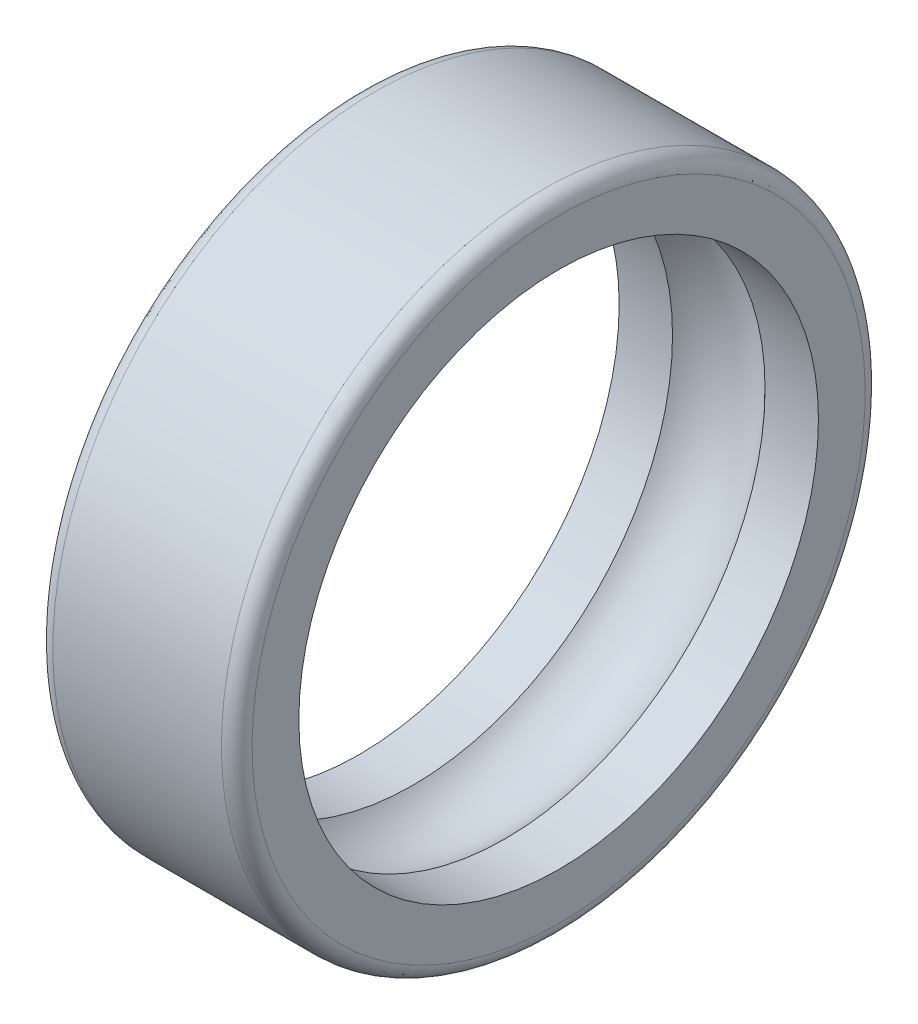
SolidWorks part; units mm, degrees
ref_plane "Plan de face" through (0, 0, 0) normal (0, 0, 1) x (1, 0, 0)
ref_plane "Plan de dessus" through (0, 0, 0) normal (0, 1, 0) x (1, 0, 0)
ref_plane "Plan de droite" through (0, 0, 0) normal (1, 0, 0) x (0, 0, -1)
sketch "Esquisse1" plane through (0, 0, 0) normal (0, 0, 1) x (1, 0, 0)
  line L0 (6.5, 21) -> (6.5, 7.5) construction
  line L1 (1, 21) -> (12, 21)
  line L2 (0, 20) -> (0, 8.5) construction
  line L3 (1, 7.5) -> (12, 7.5) construction
  line L4 (13, 20) -> (13, 8.5) construction
  line L5 (13, 16.95) -> (9.5187, 16.95)
  line L6 (13, 11.55) -> (0, 11.55) construction
  line L7 (0, 0) -> (13, 0) construction
  line L8 (13, 20) -> (13, 16.95)
  line L9 (0, 16.95) -> (0, 20)
  line L10 (3.4813, 16.95) -> (0, 16.95)
  arc A1 (0, 8.5) -> (1, 7.5) centre (1, 8.5) ccw construction
  arc A2 (1, 21) -> (0, 20) centre (1, 20) ccw
  arc A3 (13, 20) -> (12, 21) centre (12, 20) ccw
  arc A4 (12, 7.5) -> (13, 8.5) centre (12, 8.5) ccw construction
  arc A5 (9.5187, 16.95) -> (3.4813, 16.95) centre (6.5, 14.25) ccw
  dimension "D4" = 1
  dimension "D5" = 8.1
  dimension "D1" = 7.5
  dimension "D2" = 21
  dimension "D3" = 13
  dimension "D6" = 11.55
  dimension "D7" = 16.95
revolve "Révolution1" add sketch "Esquisse1" angle 360 about L7
